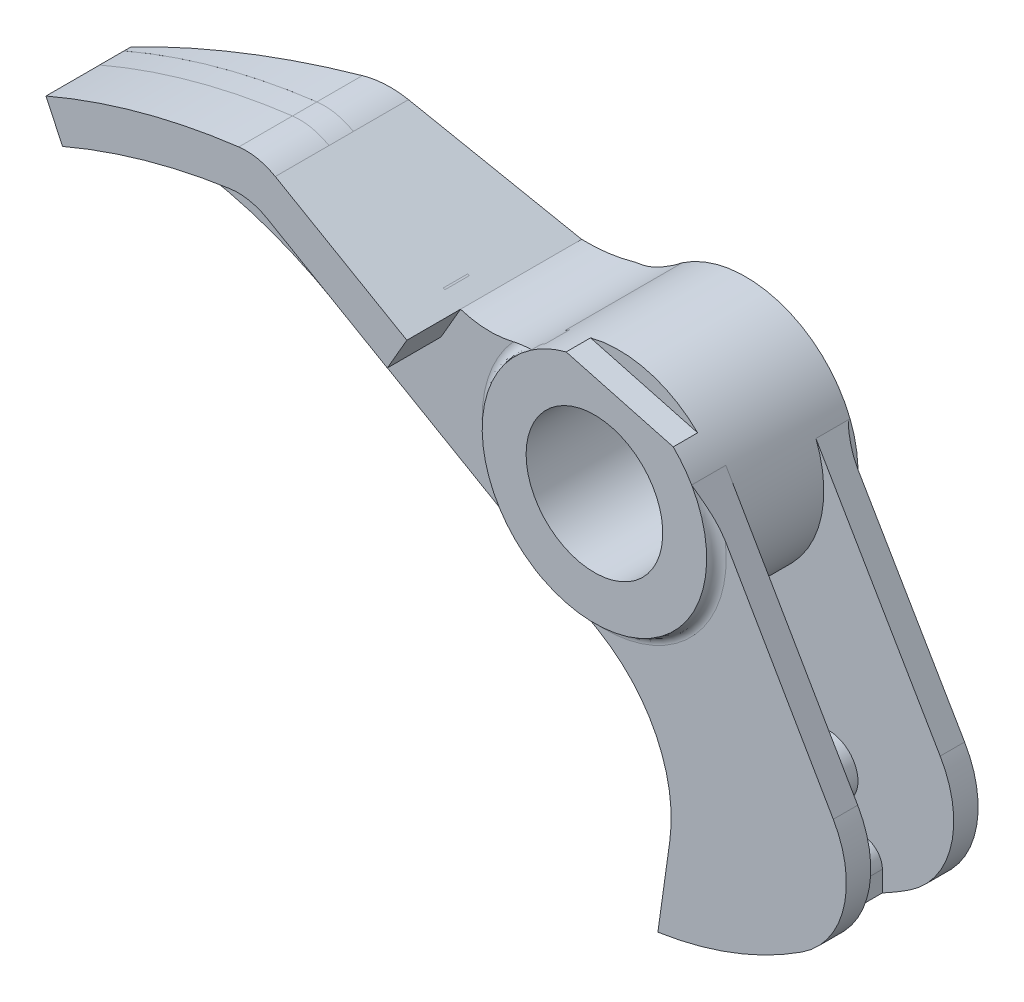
SolidWorks part; units mm, degrees
ref_plane "Plan1" through (0, 0, 0) normal (0, 0, 1) x (1, 0, 0)
ref_plane "Plan2" through (0, 0, 0) normal (0, 1, 0) x (1, 0, 0)
ref_plane "Plan3" through (0, 0, 0) normal (1, 0, 0) x (0, 0, -1)
sketch "Esquisse1" plane through (0, 0, 0) normal (0, 0, 1) x (1, 0, 0)
  line L0 (-130, 0) -> (150, 0) construction
  line L1 (0, 110) -> (0, -80) construction
  line L2 (9.9593, 5.75) -> (23.4714, -17.6536)
  line L3 (0, -24) -> (17.732, -24) construction
  line L4 (12, 20) -> (12, -60) construction
  line L5 (5.5, -12.2347) -> (5.5, -60) construction
  line L6 (-16.4744, 9.5218) -> (-28.1942, 16.2882)
  line L7 (-10.6483, -55) -> (-116.9875, -55) construction
  line L8 (-27.7671, 2.7626) -> (-0.6348, -12.9023)
  line L9 (7.2786, -24) -> (2.1621, -60.4057) construction
  line L10 (-23, -10) -> (-23, -60) construction
  line L11 (-50.0107, 8.0586) -> (-51.7012, 11.6838)
  line L12 (6.7192, -27.9803) -> (5.5, -36.6555)
  arc A0 (9.9593, 5.75) -> (-6.1375, 9.7253) centre (0, 0) ccw
  arc A1 (-50.0107, 8.0586) -> (-27.7671, 2.7626) centre (-47.7671, -31.8785) cw
  arc A2 (23.4714, -17.6536) -> (20.2876, -31.0207) centre (14.8111, -22.6536) cw
  arc A3 (6.7192, -27.9803) -> (-0.6348, -12.9023) centre (-8.1348, -25.8927) ccw
  arc A4 (5.5, -36.6555) -> (20.2876, -31.0207) centre (0, 0) ccw
  arc A5 (-6.1375, 9.7253) -> (-16.4744, 9.5218) centre (-11.4744, 18.1821) cw
  arc A6 (-31.9325, 17.0465) -> (-51.7012, 11.6838) centre (-23, -55) ccw
  arc A7 (-28.1942, 16.2882) -> (-31.9325, 17.0465) centre (-31.1942, 11.0921) ccw
  point P39 (-29.8947, 17.27)
  dimension "D1" = 23
  dimension "D5" = 10
  dimension "D11" = 8
  dimension "D13" = 4
  dimension "D15" = 15
  dimension "D16" = 6
  dimension "D17" = 10
  dimension "D6" = 5.5
  dimension "D10" = 40
  dimension "D2" = 30
  dimension "D3" = 24
  dimension "D4" = 12
  dimension "D7" = 30
  dimension "D8" = 55
  dimension "D9" = 11.5
  dimension "D12" = 23
  dimension "D14" = 25
extrude "Base-Extrusion" add sketch "Esquisse1" along normal blind 2.5
sketch "Esquisse6" plane through (0, 0, 2.5) normal (0, 0, 1) x (1, 0, 0)
  line L0 (-28.197, 16.2898) -> (-14.718, 8.5077)
  line L1 (-16.4744, 9.5218) -> (-28.1942, 16.2882) construction
  line L2 (-29.0155, 12.1436) -> (-16.718, 5.0436)
  line L3 (-51.6877, 11.6917) -> (-49.9969, 8.0645)
  line L6 (-14.718, 8.5077) -> (-16.718, 5.0436)
  arc A0 (-31.9354, 17.048) -> (-51.6877, 11.6917) centre (-23, -55) ccw
  arc A1 (-32.8796, 12.8849) -> (-49.9969, 8.0645) centre (-23, -55) ccw
  arc A2 (-29.0155, 12.1436) -> (-32.8796, 12.8849) centre (-32.0155, 6.9474) ccw
  arc A3 (-28.197, 16.2898) -> (-31.9354, 17.048) centre (-31.197, 11.0936) ccw
  dimension "D1" = 145.2
  dimension "D2" = 137.2
  dimension "D3" = 6
  dimension "D4" = 4
  dimension "D5" = 17
extrude "Boss.-Extru.2" add sketch "Esquisse6" along normal blind 5.5
sketch "Esquisse7" plane through (0, 0, 2.5) normal (0, 0, 1) x (1, 0, 0)
  circle A0 centre (0, 0) radius 11.5
  arc A1 (9.9593, 5.75) -> (-6.1375, 9.7253) centre (0, 0) ccw construction
extrude "Boss.-Extru.3" add sketch "Esquisse7" along normal blind 1
sketch "Esquisse8" plane through (0, 0, 3.5) normal (0, 0, 1) x (1, 0, 0)
  line L0 (0, 20) -> (0, -30) construction
  line L1 (0, 0) -> (3.6603, 13.6603) construction
  line L2 (-2.8972, 11.1291) -> (8.0736, 8.1894)
  arc A0 (8.0736, 8.1894) -> (-2.8972, 11.1291) centre (0, 0) ccw
  circle A1 centre (0, 0) radius 11.5 construction
  dimension "D1" = 15
  dimension "D2" = 10
extrude "Enlèv. mat.-Extru.2" cut sketch "Esquisse8" against normal blind 2.5
sketch "Esquisse9" plane through (0, 0, 0) normal (0, 0, -1) x (-1, 0, 0)
  line L0 (0, 20) -> (0, -40) construction
  line L1 (-12, 10) -> (-12, -40) construction
  line L2 (-20, 0) -> (20, 0) construction
  line L3 (-30, -24) -> (20, -24) construction
  circle A0 centre (-12, -24) radius 3
  dimension "D3" = 6
  dimension "D1" = 12
  dimension "D2" = 24
extrude "Boss.-Extru.4" add sketch "Esquisse9" along normal blind 3.75
sketch "Esquisse15" plane through (0, 0, -3.75) normal (0, 0, -1) x (-1, 0, 0)
  circle A0 centre (-12, -24) radius 2
  circle A1 centre (-12, -24) radius 3 construction
  dimension "D1" = 4
extrude "Boss.-Extru.8" add sketch "Esquisse15" along normal blind 1
sketch "Esquisse16" plane through (0, 0, -4.75) normal (0, 0, -1) x (-1, 0, 0)
  circle A0 centre (-12, -24) radius 3
  dimension "D1" = 6
extrude "Boss.-Extru.9" add sketch "Esquisse16" along normal blind 3.75
fillet "Congé3" radius 0.5
sketch "Esquisse19" plane through (0, 0, 2.5) normal (0, 0, 1) x (1, 0, 0)
  line L0 (-16.3238, 9.4348) -> (-14.718, 8.5077)
  line L1 (-28.197, 16.2898) -> (-14.718, 8.5077) construction
  line L2 (-16.3238, 9.4348) -> (-5.998, 9.8119)
  arc A0 (-5.998, 9.8119) -> (-14.718, 8.5077) centre (-11.6857, 18.0369) cw
  arc A2 (-2.8972, 11.1291) -> (8.0736, 8.1894) centre (0, 0) ccw construction
  dimension "D1" = 10
extrude "Enlèv. mat.-Extru.3" cut sketch "Esquisse19" against normal through all
sketch "Esquisse20" plane through (0, 0, 0) normal (0, 0, -1) x (-1, 0, 0)
  line L0 (11.2539, 6.5077) -> (28.197, 16.2898)
  line L1 (28.197, 16.2898) -> (14.718, 8.5077) construction
  line L2 (13.2539, 3.0436) -> (29.0155, 12.1436)
  line L3 (29.0155, 12.1436) -> (16.718, 5.0436) construction
  line L4 (11.2539, 6.5077) -> (13.2539, 3.0436)
  line L6 (51.6877, 11.6917) -> (49.9969, 8.0645)
  line L7 (51.6877, 11.6917) -> (49.9969, 8.0645) construction
  arc A0 (51.6877, 11.6917) -> (31.9354, 17.048) centre (23, -55) ccw
  arc A1 (49.9969, 8.0645) -> (32.8796, 12.8849) centre (23, -55) ccw
  arc A2 (49.9969, 8.0645) -> (32.8796, 12.8849) centre (23, -55) ccw construction
  arc A3 (51.6877, 11.6917) -> (31.9354, 17.048) centre (23, -55) ccw construction
  arc A4 (31.9354, 17.048) -> (28.197, 16.2898) centre (31.197, 11.0936) ccw
  arc A5 (32.8796, 12.8849) -> (29.0155, 12.1436) centre (32.0155, 6.9474) ccw
  dimension "D1" = 6
  dimension "D2" = 13
extrude "Boss.-Extru.10" add sketch "Esquisse20" along normal blind 11
sketch "Esquisse22" plane through (0.0045, 0.0077, 0) normal (0.5, 0.866, 0) x (-0.866, 0.5, 0)
  line L0 (13, -11) -> (60.6033, 2.0228)
  line L1 (36.1809, -11) -> (50.6087, -11) construction
  line L5 (60.6033, -11) -> (60.6033, 2.0228)
  line L11 (13, -11) -> (60.6033, -11)
  dimension "D1" = 15.3
extrude "Enlèv. mat.-Extru.5" cut sketch "Esquisse22" against normal through all
sketch "Esquisse23" plane through (0, 0, 0) normal (0, 0, -1) x (-1, 0, 0)
  circle A0 centre (0, 0) radius 11.5
  arc A1 (5.998, 9.8119) -> (-9.9593, 5.75) centre (0, 0) ccw construction
extrude "Boss.-Extru.11" add sketch "Esquisse23" along normal blind 11
sketch "Esquisse24" plane through (0, 0, -8.5) normal (0, 0, -1) x (-1, 0, 0)
  line L0 (-10.69, 4.2395) -> (-23.4227, -17.5702)
  line L1 (-6.8218, -27.0327) -> (-5.5, -36.6555)
  line L2 (2.0847, -12.1669) -> (5.1235, -10.2956)
  circle A0 centre (0, 0) radius 11.5 construction
  arc A1 (-10.69, 4.2395) -> (5.1235, -10.2956) centre (0, 0) ccw
  arc A2 (2.0847, -12.1669) -> (-6.8218, -27.0327) centre (8.1348, -25.8927) ccw
  arc A3 (-20.2876, -31.0207) -> (-5.5, -36.6555) centre (0, 0) ccw construction
  arc A4 (0.6348, -12.9023) -> (-6.7192, -27.9803) centre (8.1348, -25.8927) ccw construction
  arc A5 (-23.4227, -17.5702) -> (-20.2834, -31.0235) centre (-14.8111, -22.6536) ccw
  arc A6 (-23.4714, -17.6536) -> (-20.2876, -31.0207) centre (-14.8111, -22.6536) ccw construction
  arc A7 (-5.5, -36.6555) -> (-20.2834, -31.0235) centre (0, 0) cw
extrude "Boss.-Extru.12" add sketch "Esquisse24" along normal blind 2.5
sketch "Esquisse25" plane through (0, 0, -11) normal (0, 0, -1) x (-1, 0, 0)
  circle A0 centre (0, 0) radius 11.5
  arc A1 (5.1235, -10.2956) -> (-10.69, 4.2395) centre (0, 0) ccw construction
extrude "Boss.-Extru.13" add sketch "Esquisse25" along normal blind 1
sketch "Esquisse26" plane through (0, 0, -12) normal (0, 0, -1) x (-1, 0, 0)
  circle A0 centre (0, 0) radius 7
  dimension "D1" = 14
extrude "Enlèv. mat.-Extru.6" cut sketch "Esquisse26" against normal through all
sketch "Esquisse27" plane through (0, 0, -8.5) normal (0, 0, 1) x (1, 0, 0)
  line L0 (5.5, -36.6555) -> (6.1995, -31.6782)
  line L1 (17.5, -32.6745) -> (17.5, -27.1236)
  arc A0 (6.1995, -31.6782) -> (17.5, -27.1236) centre (0, 0) ccw
  arc A2 (17.5, -32.6745) -> (5.5, -36.6555) centre (0, 0) cw
  arc A3 (5.5, -36.6555) -> (20.2876, -31.0207) centre (0, 0) ccw construction
  dimension "D1" = 12
extrude "Boss.-Extru.14" add sketch "Esquisse27" along normal blind 8.5
fillet "Congé4" radius 2
sketch "Esquisse29" plane through (0, 0, 0) normal (0, 0, -1) x (-1, 0, 0)
  line L0 (14.718, 8.5077) -> (11.2539, 6.5077)
  line L1 (11.2539, 6.5077) -> (13.2539, 3.0436)
  line L2 (13.2539, 3.0436) -> (11.3358, 1.9362)
  arc A0 (6.5036, 9.4843) -> (14.718, 8.5077) centre (11.6857, 18.0369) ccw
  arc A1 (11.3358, 1.9362) -> (6.5036, 9.4843) centre (0, 0) ccw
  circle A2 centre (0, 0) radius 11.5 construction
  arc A4 (6.5036, 9.4843) -> (14.718, 8.5077) centre (11.6857, 18.0369) ccw construction
extrude "Boss.-Extru.15" add sketch "Esquisse29" along normal blind 11
sketch "Esquisse30" plane through (0.0045, 0.0077, 0) normal (-0.5, -0.866, 0) x (0.866, -0.5, 0)
  line L1 (-31.1999, -6.0211) -> (-13, -11) construction
  line L3 (-13, -11) -> (-17, -11)
  line L4 (-17, -9.9057) -> (-17, -11)
  line L5 (-17, -9.9057) -> (-13, -11)
extrude "Enlèv. mat.-Extru.7" cut sketch "Esquisse30" against normal through all
fillet "Congé8" radius 1
fillet "Congé9" radius 0.25
ref_plane "Plan5" through (12, 0, 0) normal (1, 0, 0) x (0, 0, -1)
sketch "Esquisse31" plane through (12, 0, 0) normal (1, 0, 0) x (0, 0, -1)
  line L0 (4.25, -20.08) -> (4.25, -28.44) construction
  line L1 (4.25, -26) -> (4.25, -22) construction
  line L2 (3.75, -27) -> (3.75, -21) construction
  line L4 (-1.6886, -24) -> (9.9134, -24) construction
  line L5 (3.75, -24) -> (0, -24) construction
  circle A0 centre (4.25, -21.56) radius 0.5
revolve "Enlèvement de matière-Révolution1" cut sketch "Esquisse31" angle 360 about L4
